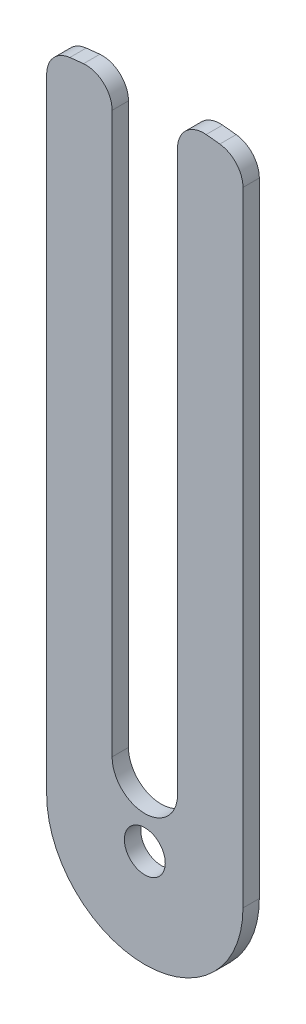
SolidWorks part; units mm, degrees
ref_plane "Front Plane" through (0, 0, 0) normal (0, 0, 1) x (1, 0, 0)
ref_plane "Top Plane" through (0, 0, 0) normal (0, 1, 0) x (1, 0, 0)
ref_plane "Right Plane" through (0, 0, 0) normal (1, 0, 0) x (0, 0, -1)
sketch "Sketch1" plane through (0, 0, 0) normal (0, 0, 1) x (1, 0, 0)
  line L1 (-19.05, 0) -> (19.05, 0)
  line L2 (-19.05, 0) -> (-19.05, 127)
  line L3 (-19.05, 127) -> (19.05, 127)
  line L4 (19.05, 0) -> (19.05, 127)
  line L5 (-6.35, 127) -> (6.35, 127)
  line L6 (-6.35, 127) -> (-6.35, 12.7)
  line L7 (-6.35, 12.7) -> (6.35, 12.7)
  line L8 (6.35, 127) -> (6.35, 12.7)
  circle A0 centre (0, 0) radius 3.9688
  circle A1 centre (0, 0) radius 19.05
  arc A2 (-6.35, 12.7) -> (6.35, 12.7) centre (0, 12.7) ccw
  circle A3 centre (0, 0) radius 127
  point P8 (0, 12.7)
  point P13 (0, 127)
  dimension "D1" = 7.9375
  dimension "D2" = 38.1
  dimension "D6" = 254
  dimension "D3" = 127
  dimension "D4" = 114.3
  dimension "D5" = 12.7
extrude "Boss-Extrude1" add sketch "Sketch1" along normal blind 3.175 contours L6 A3 L2 A1 | L1 A1 A0 | A2 L6 A1 L1 A0 L8 | L4 A3 L8 A1
fillet "Fillet1" radius 5.08 4 edges at (19.05, 125.5631, 1.5875) (6.35, 126.8412, 1.5875) (-6.35, 126.8412, 1.5875) (-19.05, 125.5631, 1.5875)
